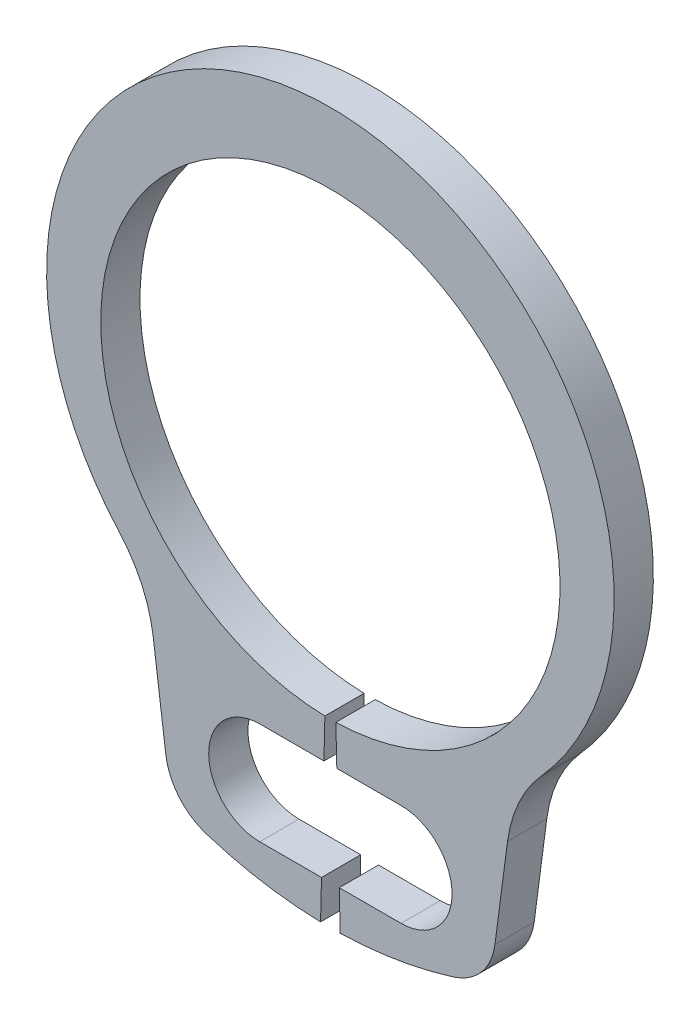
SolidWorks part; units mm, degrees
ref_plane "Plane1" through (0, 0, 0) normal (0, 0, 1) x (1, 0, 0)
ref_plane "Plane2" through (0, 0, 0) normal (0, 1, 0) x (1, 0, 0)
ref_plane "Plane3" through (0, 0, 0) normal (1, 0, 0) x (0, 0, -1)
sketch "Clipboard" plane through (0, 0, 0) normal (0, 0, 1) x (1, 0, 0)
  line L0 (0, 0) -> (0.4572, 0)
  line L1 (0, 0) -> (0, 0.2794)
  line L2 (0, 0) -> (0, -1.1684)
  circle A0 centre (0, 0) radius 0.3302
  circle A1 centre (0, 0) radius 1.5875
  dimension "HoleDia" = 0.6604
  dimension "ShaftDia" = 3.175
  dimension "LargeSection" = 0.4572
  dimension "SmallSection" = 0.2794
  dimension "LugSection" = 1.1684
sketch "BodySke" plane through (0, 0, 0) normal (0, 0, 1) x (1, 0, 0)
  line L0 (-1.5431, 0) -> (1.5431, 0) construction
  line L1 (0, 0) -> (0, 1.9431) construction
  line L2 (0.0355, -1.4855) -> (0.0635, -2.6535)
  line L3 (-0.0355, -1.4855) -> (-0.0635, -2.6535)
  line L4 (0, 0) -> (2.0272, -1.7134) construction
  line L5 (0, 0) -> (-2.0272, -1.7134) construction
  line L7 (1.1464, -1.5974) -> (1.0649, -2.2167)
  line L8 (-1.1464, -1.5974) -> (-1.0649, -2.2167)
  circle A0 centre (0, 0) radius 1.4859 construction
  arc A1 (0.0355, -1.4855) -> (-0.0355, -1.4855) centre (0, 0) ccw
  arc A2 (1.3482, -1.1395) -> (-1.3482, -1.1395) centre (0, 0.1069) ccw construction
  arc A3 (0.0635, -2.6535) -> (0.8023, -2.5301) centre (0, 0) ccw
  arc A4 (1.3662, -1.1198) -> (1.1464, -1.5974) centre (2.0272, -1.7134) ccw
  arc A5 (-1.1464, -1.5974) -> (-1.3662, -1.1198) centre (-2.0272, -1.7134) ccw
  arc A6 (-0.8023, -2.5301) -> (-0.0635, -2.6535) centre (0, 0) ccw
  arc A7 (1.3662, -1.1198) -> (-1.3662, -1.1198) centre (0, 0.1069) ccw
  arc A8 (-1.1196, -1.8013) -> (1.1196, -1.8013) centre (0, 0) ccw construction
  circle A9 centre (0.4572, -2.071) radius 0.3302
  circle A10 centre (-0.4572, -2.071) radius 0.3302
  arc A11 (1.0649, -2.2167) -> (0.8023, -2.5301) centre (0.6871, -2.167) cw
  arc A12 (-1.0649, -2.2167) -> (-0.8023, -2.5301) centre (-0.6871, -2.167) ccw
  point P28 (1.0349, -2.4442)
  point P31 (-1.0349, -2.4442)
  dimension "GrooveDia" = 2.9718
  dimension "D3" = 0.381
  dimension "LugRad" = 2.6543
  dimension "HoleOffsetRad" = 2.1209
  dimension "HoleDia" = 0.6604
  dimension "D2" = 15
  dimension "LargeRad" = 1.9431
  dimension "SmallRad" = 1.7653
  dimension "Gap" = 0.127
  dimension "SmallAngle" = 99.591
  dimension "HoleSpacing" = 0.9144
extrude "Body" add sketch "BodySke" against normal blind 0.254
sketch "NotSke" plane through (0, 0, 0) normal (0, 0, 1) x (1, 0, 0)
  line L0 (0.4572, -1.7408) -> (0.4572, -2.4012)
  line L1 (0.4572, -2.4012) -> (-0.4572, -2.4012)
  line L2 (-0.4572, -2.4012) -> (-0.4572, -1.7408)
  line L3 (-0.4572, -1.7408) -> (0.4572, -1.7408)
  circle A0 centre (0.4572, -2.071) radius 0.3302 construction
  circle A1 centre (-0.4572, -2.071) radius 0.3302 construction
extrude "Notch" cut sketch "NotSke" against normal through all
equation "' \"ShaftDia@Clipboard\" = 0.125"
equation "' \"Thickness@Body\" = 0.01"
equation "' \"GrooveDia@BodySke\" = 0.117"
equation "' \"LugSection@Clipboard\" = 0.046"
equation "' \"LargeSection@Clipboard\" = 0.018"
equation "' \"SmallSection@Clipboard\" = 0.011"
equation "' \"HoleDia@Clipboard\" = 0.026"
equation "' \"ShaftDia@Clipboard\" = 0.394"
equation "' \"Thickness@Body\" = 0.025"
equation "' \"GrooveDia@BodySke\" = 0.369"
equation "' \"LugSection@Clipboard\" = 0.087"
equation "' \"LargeSection@Clipboard\" = 0.052"
equation "' \"SmallSection@Clipboard\" = 0.031"
equation "' \"HoleDia@Clipboard\" = 0.041"
equation "\"Gap@BodySke\" =  \"Thickness@Body\" / 2"
equation "\"LargeRad@BodySke\" =  \"GrooveDia@BodySke\" / 2 +  \"LargeSection@Clipboard\""
equation "\"SmallRad@BodySke\" =  \"GrooveDia@BodySke\" / 2 +  \"SmallSection@Clipboard\""
equation "\"LugRad@BodySke\" = \"GrooveDia@BodySke\" / 2 + \"LugSection@Clipboard\""
equation "\"HoleOffsetRad@BodySke\" = (  \"ShaftDia@Clipboard\" / 2 + \"LugRad@BodySke\" ) / 2"
equation "\"HoleSpacing@BodySke\" = \"Gap@BodySke\"  * 2 +  \"HoleDia@Clipboard\""
equation "\"HoleDia@BodySke\" =  \"HoleDia@Clipboard\""
equation "\"SmallAngle@BodySke\" = atn(\"HoleSpacing@BodySke\" / 2 / sqr(\"HoleOffsetRad@BodySke\"  * \"HoleOffsetRad@BodySke\" - (\"HoleSpacing@BodySke\" / 2) * (\"HoleSpacing@BodySke\" / 2) ))  * 8 * ( 180 / 3.141593)"
